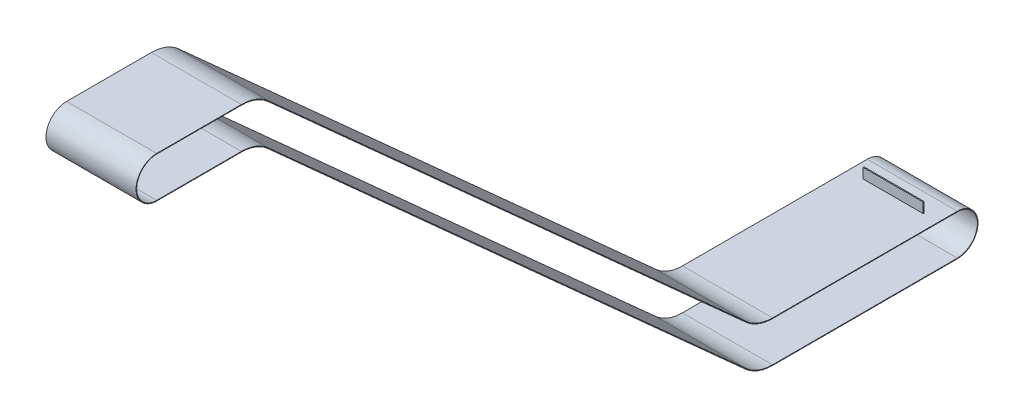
SolidWorks part; units mm, degrees
ref_plane "Front Plane" through (0, 0, 0) normal (0, 0, 1) x (1, 0, 0)
ref_plane "Top Plane" through (0, 0, 0) normal (0, 1, 0) x (1, 0, 0)
ref_plane "Right Plane" through (0, 0, 0) normal (1, 0, 0) x (0, 0, -1)
sketch "Sketch1" plane through (0, 0, 0) normal (1, 0, 0) x (0, 0, -1)
  line L0 (-5475.7282, 0) -> (6538.835, 0) construction
  line L1 (4000, -2250) -> (2153.4944, -2250)
  line L5 (4000, -2250) -> (-4000, 2250) construction
  line L6 (4000, 2250) -> (-4000, -2250) construction
  line L7 (-3000, 3123.7864) -> (-3000, -3269.4175) construction
  line L8 (2000, 3123.7864) -> (2000, -3822.8155) construction
  line L9 (-2885.9085, 2147.3177) -> (1885.9085, -2147.3177)
  line L11 (-3153.4944, 2250) -> (-4000, 2250)
  line L12 (-4000, 1850) -> (-3153.4944, 1850)
  line L16 (4000, -2650) -> (2153.4944, -2650)
  line L17 (1885.9085, -2547.3177) -> (-2885.9085, 1747.3177)
  arc A0 (1885.9085, -2147.3177) -> (2153.4944, -2250) centre (2153.4944, -1850) ccw
  arc A1 (-2885.9085, 2147.3177) -> (-3153.4944, 2250) centre (-3153.4944, 1850) ccw
  arc A2 (-4000, 2250) -> (-4000, 1850) centre (-4000, 2050) ccw
  arc A3 (4000, -2650) -> (4000, -2250) centre (4000, -2450) ccw
  arc A4 (1885.9085, -2547.3177) -> (2153.4944, -2650) centre (2153.4944, -2250) ccw
  arc A5 (-2885.9085, 1747.3177) -> (-3153.4944, 1850) centre (-3153.4944, 1450) ccw
  point P0 (0, 0)
  point P16 (2000, -2250)
  point P19 (-3000, 2250)
  point P29 (2000, -2650)
  point P32 (-3000, 1850)
  dimension "D6" = 400
  dimension "D7" = 400
  dimension "D1" = 4500
  dimension "D2" = 4500
  dimension "D3" = 8000
  dimension "D4" = 2000
  dimension "D5" = 1000
extrude "Extrude-Thin1" add sketch "Sketch1" along normal mid plane 900 thin
sketch "Sketch2" plane through (0, -2244, 0) normal (0, 1, 0) x (1, 0, 0)
  line L0 (-450, 4000) -> (-450, 2153.4944) construction
  line L1 (-300, 3818.0046) -> (300, 3818.0046)
  line L2 (-300, 3818.0046) -> (-300, 3808.0046)
  line L3 (-300, 3808.0046) -> (300, 3808.0046)
  line L4 (300, 3818.0046) -> (300, 3808.0046)
  line L5 (-300, 3818.0046) -> (300, 3808.0046) construction
  line L6 (-300, 3808.0046) -> (300, 3818.0046) construction
  point P0 (0, 3813.0046)
  dimension "D1" = 600
  dimension "D2" = 10
  dimension "D3" = 150
extrude "Boss-Extrude1" add sketch "Sketch2" along normal blind 100
